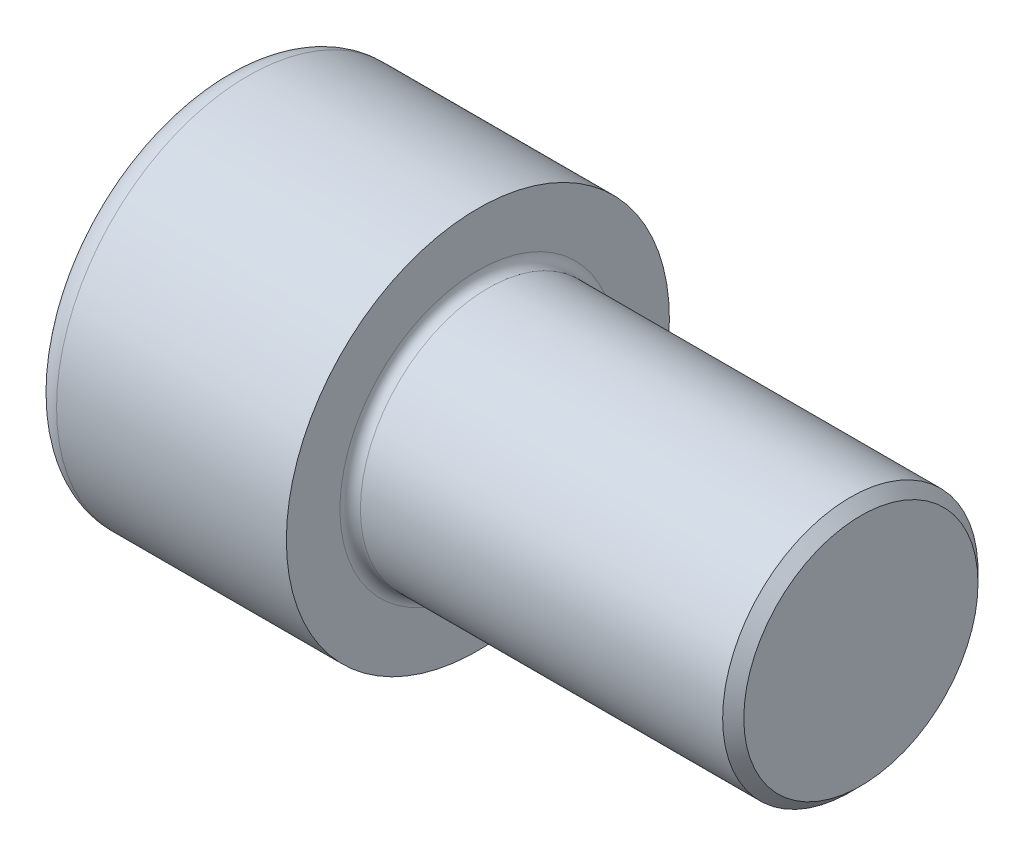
SolidWorks part; units mm, degrees
ref_plane "Plane1" through (0, 0, 0) normal (0, 0, 1) x (1, 0, 0)
ref_plane "Plane2" through (0, 0, 0) normal (0, 1, 0) x (1, 0, 0)
ref_plane "Plane3" through (0, 0, 0) normal (1, 0, 0) x (0, 0, -1)
sketch "BodySke" plane through (0, 0, 0) normal (0, 0, 1) x (1, 0, 0)
  line L0 (0, 0) -> (0, 15)
  line L1 (0, 15) -> (20, 15)
  line L2 (20, 15) -> (20, 10)
  line L3 (20, 10) -> (49.172, 10)
  line L4 (50, 9.172) -> (50, 0)
  line L5 (50, 0) -> (0, 0)
  line L6 (-31.75, 0) -> (127, 0) construction
  line L8 (50, 9.172) -> (49.172, 10)
  line L10 (50, -9.172) -> (49.172, -10) construction
  line L11 (21.5, 9.525) -> (21.5, 3.175) construction
  line L12 (20, 9.525) -> (20, 3.175) construction
  line L13 (-10, 9.525) -> (-10, 3.175) construction
  dimension "Diameter" = 20
  dimension "Head_ht" = 20
  dimension "Length" = 30
  dimension "Body_ch_ang" = 45
  dimension "Head_dia" = 30
  dimension "Minor_dia" = 18.344
  dimension "Advance" = 1.5
  dimension "Thread_nom" = 30
  dimension "Thread_length" = 60
revolve "Base-Revolve" add sketch "BodySke"
fillet "Fillet1" radius 0.8 1 edges at (20, 0, 10)
fillet "Fillet2" radius 2 1 edges at (0, 0, 15)
sketch "Sketch2" plane through (0, 0, 0) normal (0, 0, 1) x (1, 0, 0)
  line L0 (0, 8.525) -> (10, 8.525)
  line L1 (10, 8.525) -> (14.9219, 0)
  line L2 (-31.75, 0) -> (127, 0) construction
  line L3 (14.9219, 0) -> (0, 0)
  line L4 (0, 0) -> (0, 8.525)
  line L6 (0, 0) -> (47.625, 0) construction
  dimension "D1" = 8.525
  dimension "D2" = 60
  dimension "Depth" = 10
revolve "Hex-PreBroach" cut sketch "Sketch2" angle 360 about L6
sketch "Sketch3" plane through (0, 0, 0) normal (-1, 0, 0) x (0, 0.5, 0.866)
  line L0 (4.9219, 8.525) -> (-4.9219, 8.525)
  line L1 (-4.9219, 8.525) -> (-9.8438, 0)
  line L2 (4.9219, 8.525) -> (9.8438, 0)
  line L3 (4.9219, -8.525) -> (9.8438, 0)
  line L4 (4.9219, -8.525) -> (-4.9219, -8.525)
  line L5 (-4.9219, -8.525) -> (-9.8438, 0)
  dimension "D1" = 8.525
  dimension "D2" = 8.525
  dimension "Hex_size" = 17.05
extrude "Hex" cut sketch "Sketch3" against normal blind 10
sketch "ThdSchSke" plane through (0, 0, 0) normal (0, 0, 1) x (1, 0, 0)
  line L0 (24.5, -9.172) -> (23.9202, -10)
  line L1 (24.5, -9.172) -> (25.0798, -10)
  line L2 (25.0798, -10) -> (25.0798, -12.5)
  line L3 (-3.175, 0) -> (5.1513, 0) construction
  line L4 (0, 13) -> (0, -13) construction
  line L5 (25.0798, -12.5) -> (23.9202, -12.5)
  line L6 (23.9202, -12.5) -> (23.9202, -10)
  dimension "Thread_minor" = 18.344
  dimension "Diameter" = 20
  dimension "Start" = 24.5
  dimension "SideAngle" = 55
  dimension "VeeAngle" = 70
  dimension "Overcut" = 25
revolve "ThreadSchematic" [suppressed] cut sketch "ThdSchSke" angle 360 about L3
pattern_linear "ThdSchPat" [suppressed]
equation "\"D2@Sketch3\" = \"Hex_size@Sketch3\" / 2"
equation "\"D1@Sketch3\" = \"Hex_size@Sketch3\" / 2"
equation "\"D1@Sketch2\" = \"Hex_size@Sketch3\" / 2"
equation "\"Thread_minor@ThreadCosmetic\"  =  \"Minor_dia@BodySke\""
equation "\"Depth@Sketch2\" =  \"Key_eng@Hex\""
equation "\"Thread_length@ThreadCosmetic\" = ((sgn( (\"Length@BodySke\" - \"Advance@BodySke\" * 3.0) - \"Thread_nom@BodySke\" )-1)*( (\"Length@BodySke\" - \"Advance@BodySke\" * 3.0) - \"Thread_nom@BodySke\" ))/-2+ \"Thread_no"
equation "\"Thread_minor@ThdSchSke\" = \"Minor_dia@BodySke\""
equation "\"Diameter@ThdSchSke\" = \"Diameter@BodySke\""
equation "\"Overcut@ThdSchSke\" = \"Diameter@BodySke\" * 1.25"
equation "\"Start@ThdSchSke\" = \"Head_ht@BodySke\" + \"Length@BodySke\" - \"Thread_length@ThreadCosmetic\"  '---Non-countersunk---"
equation "\"Num_threads@ThdSchPat\" = int( \"Thread_length@ThreadCosmetic\" / \"Advance@BodySke\" + 0.999 )  + 1"
equation "\"Advance@ThdSchPat\" = \"Thread_length@ThreadCosmetic\" /  (\"Num_threads@ThdSchPat\" - 1) 'relax it"
equation "\"Num_threads@ThdSchPat\" = \"Num_threads@ThdSchPat\" - sgn( \"Num_threads@ThdSchPat\" - 1) '---chamfered tips only---"
